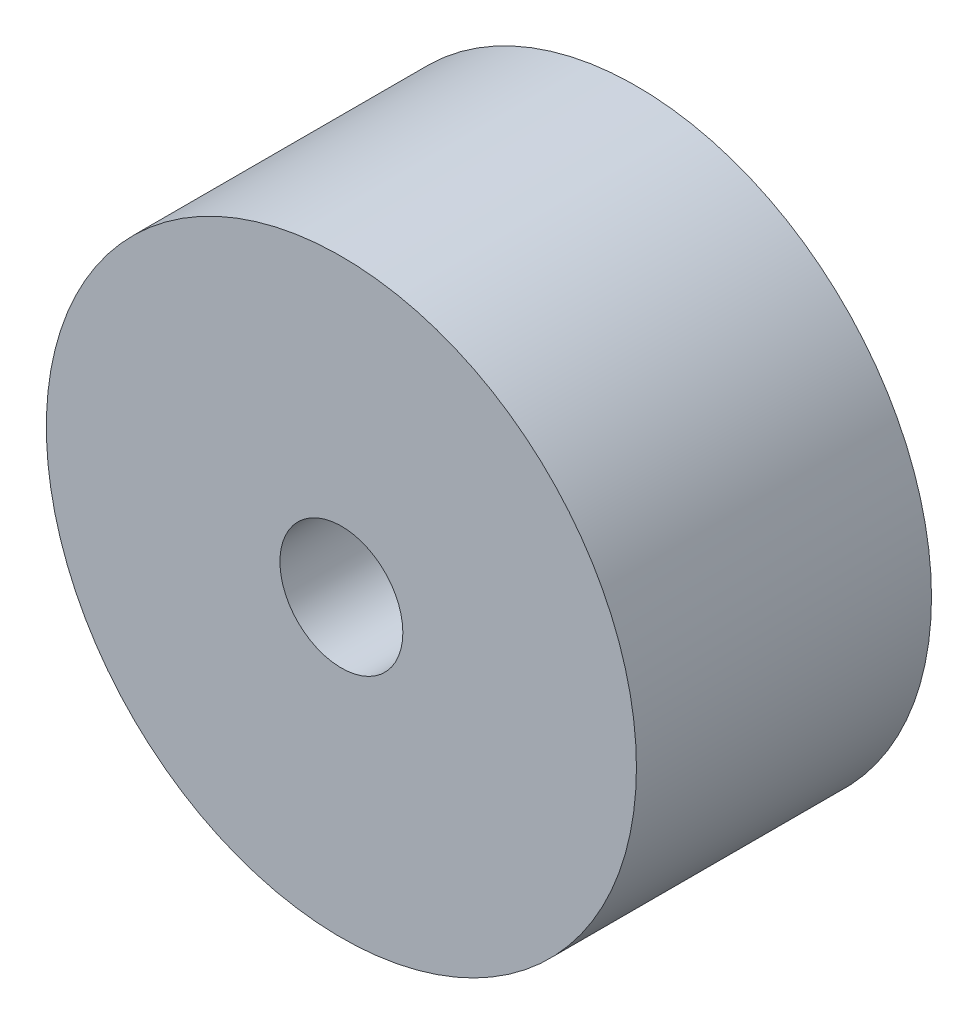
SolidWorks part; units mm, degrees
ref_plane "Ön Düzlem" through (0, 0, 0) normal (0, 0, 1) x (1, 0, 0)
ref_plane "Üst Düzlem" through (0, 0, 0) normal (0, 1, 0) x (1, 0, 0)
ref_plane "Sağ Düzlem" through (0, 0, 0) normal (1, 0, 0) x (0, 0, -1)
sketch "Çizim1" plane through (0, 0, 0) normal (0, 0, 1) x (1, 0, 0)
  circle A0 centre (0, 0) radius 6
  circle A1 centre (0, 0) radius 1.25
  dimension "D1" = 2.5
  dimension "D2" = 12
extrude "Yükseklik-Ekstrüzyon1" add sketch "Çizim1" along normal blind 6
